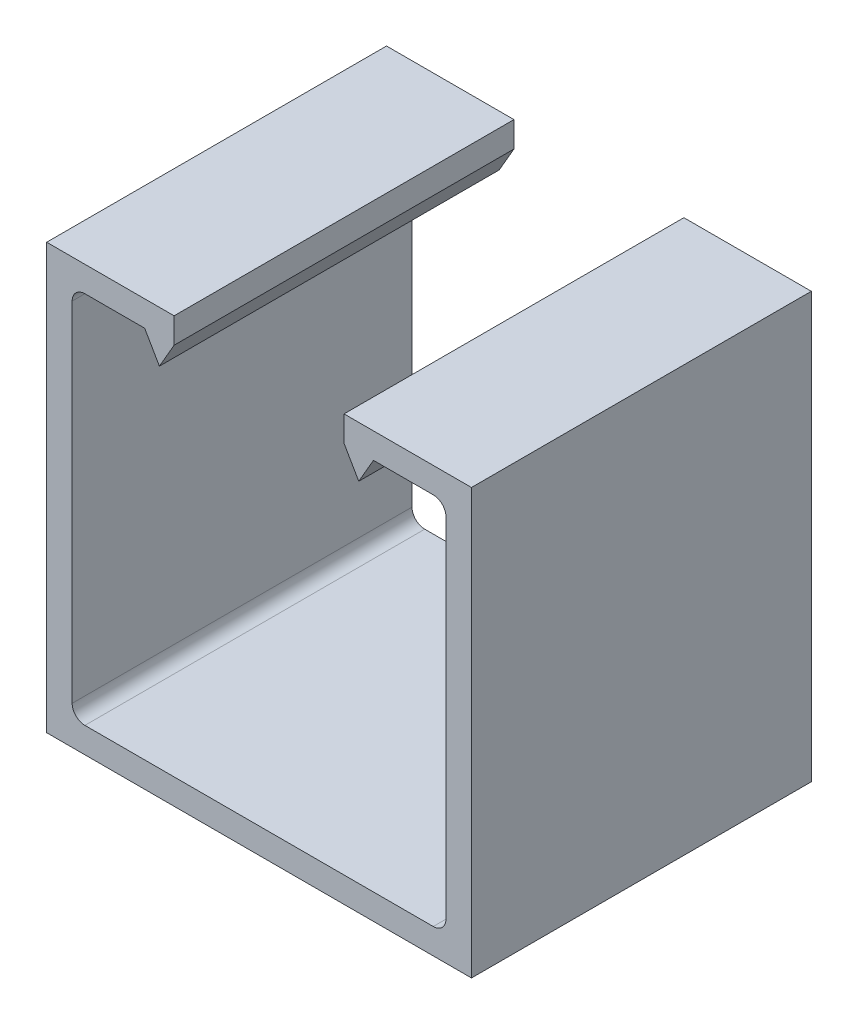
SolidWorks part; units mm, degrees
ref_plane "Plane1" through (0, 0, 0) normal (0, 0, 1) x (1, 0, 0)
ref_plane "Plane2" through (0, 0, 0) normal (0, 1, 0) x (1, 0, 0)
ref_plane "Plane3" through (0, 0, 0) normal (1, 0, 0) x (0, 0, -1)
sketch "Sketch1" plane through (0, 0, 0) normal (0, 0, 1) x (1, 0, 0)
  line L0 (-6.35, 15.875) -> (-15.875, 15.875)
  line L1 (-15.875, 15.875) -> (-15.875, -15.875)
  line L2 (-15.875, -15.875) -> (15.875, -15.875)
  line L3 (15.875, -15.875) -> (15.875, 15.875)
  line L4 (15.875, 15.875) -> (6.35, 15.875)
  line L5 (13.0175, 13.97) -> (8.5497, 13.97)
  line L6 (13.97, -13.0175) -> (13.97, 13.0175)
  line L7 (-13.0175, -13.97) -> (13.0175, -13.97)
  line L8 (-13.97, 13.0175) -> (-13.97, -13.0175)
  line L9 (-8.5497, 13.97) -> (-13.0175, 13.97)
  line L10 (8.5497, 13.97) -> (7.4499, 12.065)
  line L11 (7.4499, 12.065) -> (6.35, 13.97)
  line L12 (6.35, 13.97) -> (6.35, 15.875)
  line L13 (-8.5497, 13.97) -> (-7.4499, 12.065)
  line L14 (-7.4499, 12.065) -> (-6.35, 13.97)
  line L15 (-6.35, 13.97) -> (-6.35, 15.875)
  arc A0 (-13.97, -13.0175) -> (-13.0175, -13.97) centre (-13.0175, -13.0175) ccw
  arc A1 (-13.0175, 13.97) -> (-13.97, 13.0175) centre (-13.0175, 13.0175) ccw
  arc A2 (13.97, 13.0175) -> (13.0175, 13.97) centre (13.0175, 13.0175) ccw
  arc A3 (13.0175, -13.97) -> (13.97, -13.0175) centre (13.0175, -13.0175) ccw
  dimension "D5" = 0.9525
  dimension "D4" = 60
  dimension "Width" = 31.75
  dimension "Height" = 31.75
  dimension "D8" = 15.875
  dimension "D9" = 15.875
  dimension "D10" = 12.7
  dimension "edge" = 9.525
  dimension "D13" = 1.0999
extrude "Base-Extrude" add sketch "Sketch1" along normal mid plane 25.4
equation "\"D8@Sketch1\" = \"Width@Sketch1\" / 2"
equation "\"D9@Sketch1\" = \"Height@Sketch1\" / 2"
equation "\"D10@Sketch1\" = \"Width@Sketch1\" - 2 * \"edge@Sketch1\""
equation "\"D5@Sketch1\" = \"gauge@Sketch1\" / 2"
equation "\"D13@Sketch1\" = \"gauge@Sketch1\" * .577350269"
